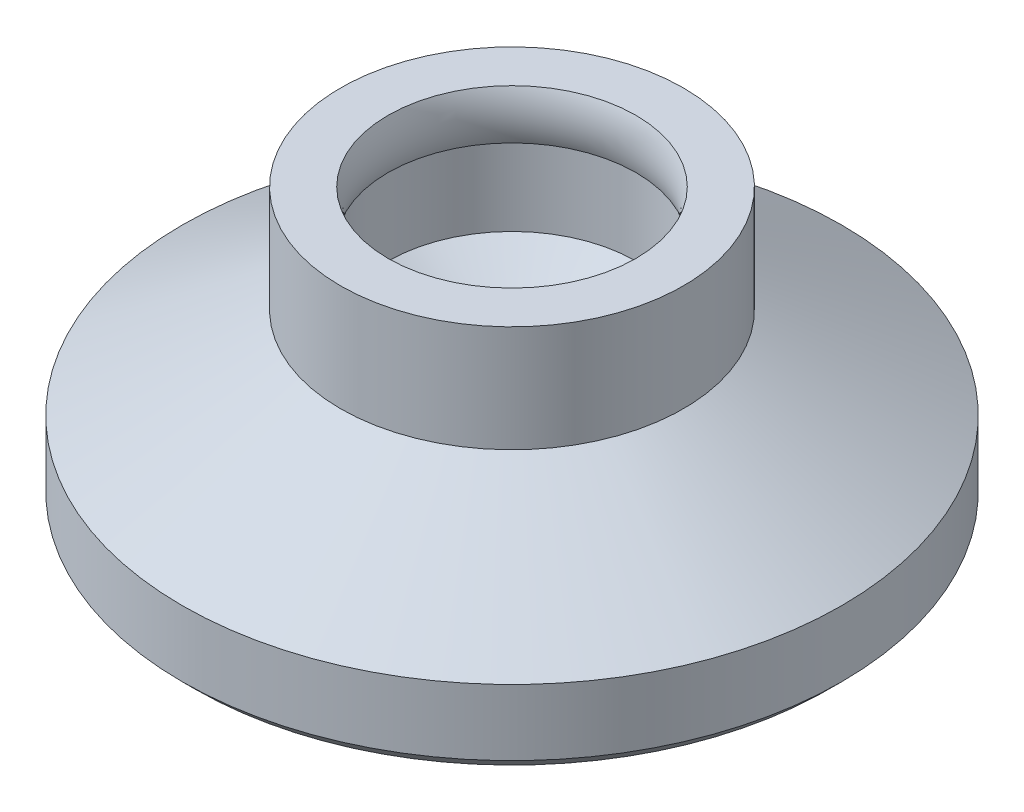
SolidWorks part; units mm, degrees
ref_plane "Front Plane" through (0, 0, 0) normal (0, 0, 1) x (1, 0, 0)
ref_plane "Top Plane" through (0, 0, 0) normal (0, 1, 0) x (1, 0, 0)
ref_plane "Right Plane" through (0, 0, 0) normal (1, 0, 0) x (0, 0, -1)
sketch "Sketch1" plane through (0, 0, 0) normal (0, 1, 0) x (1, 0, 0)
  circle A0 centre (0, 0) radius 6.5
  dimension "D1" = 13
extrude "Extrude1" add sketch "Sketch1" along normal mid plane 10.5
sketch "Sketch3" plane through (0, -5.25, 0) normal (0, -1, 0) x (1, 0, 0)
  circle A0 centre (0, 0) radius 12.5
  dimension "D1" = 25
extrude "Extrude2" add sketch "Sketch3" against normal blind 3
sketch "Sketch4" plane through (0, 0, 0) normal (0, 0, 1) x (1, 0, 0)
  line L0 (-12.5, -2.25) -> (-6.5, 1.2141)
  line L1 (-6.5, 5.25) -> (-6.5, -2.25) construction
  line L2 (-6.5, 1.2141) -> (-6.5, -2.25)
  line L3 (-6.5, -2.25) -> (-12.5, -2.25)
  dimension "D1" = 30
revolve "Revolve1" add sketch "Sketch4" angle 360 about axis through (0, 5.25, 0) along (0, -1, 0)
chamfer "Chamfer1" distance 0.5 angle 45 1 edges at (0, -5.25, -12.5)
sketch "Sketch5" plane through (0, 0, 0) normal (0, 0, 1) x (1, 0, 0)
  line L1 (0, 0) -> (0, 11.3083) construction
  line L2 (0, 5.25) -> (4.7, 5.25)
  line L3 (6.5, 5.25) -> (-6.5, 5.25) construction
  line L4 (4.7, 3.37) -> (4.7, 0.4635)
  line L5 (4.7, 0.4635) -> (0, -2.25)
  line L6 (0, -2.25) -> (0, 5.25)
  line L7 (12.5, -2.25) -> (-12.5, -2.25) construction
  arc A0 (4.7, 5.25) -> (4.7, 3.37) centre (6.956, 4.31) ccw
  point P14 (4.512, 4.31)
  dimension "D2" = 9.4
  dimension "D1" = 60
  dimension "D3" = 1.88
  dimension "D4" = 0.188
revolve "Cut-Revolve1" cut sketch "Sketch5" angle 360 about L1
equation "\"D3@Sketch5\" = \"D2@Sketch5\"*0.2"
equation "\"D4@Sketch5\" = \"D3@Sketch5\"*0.1"
